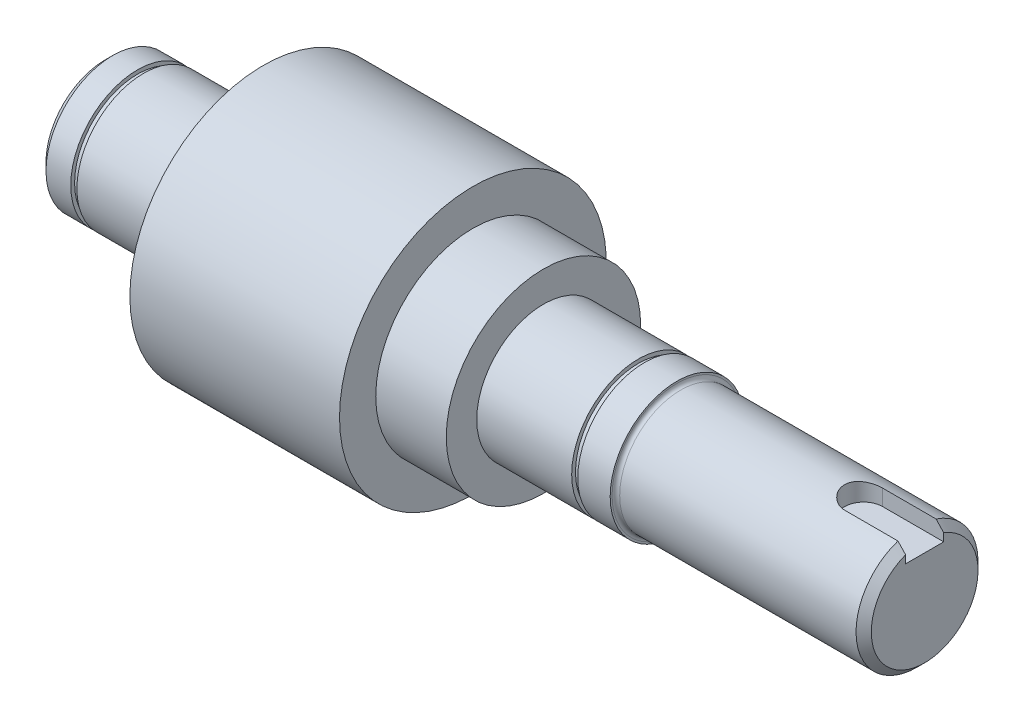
SolidWorks part; units mm, degrees
ref_plane "Plan1" through (0, 0, 0) normal (0, 0, 1) x (1, 0, 0)
ref_plane "Plan2" through (0, 0, 0) normal (0, 1, 0) x (1, 0, 0)
ref_plane "Plan3" through (0, 0, 0) normal (1, 0, 0) x (0, 0, -1)
sketch "Esquisse1" plane through (0, 0, 0) normal (0, 0, 1) x (1, 0, 0)
  line L0 (-77.9877, 0) -> (164.4815, 0) construction
  line L1 (-27.5, 35) -> (27.5, 35)
  line L2 (-27.5, 35) -> (-27.5, 25.5)
  line L3 (146, 16) -> (146, 0)
  line L4 (27.5, 35) -> (27.5, 25.5)
  line L5 (-34, 25.5) -> (-27.5, 25.5)
  line L6 (-34, 25.5) -> (-34, 17.5)
  line L7 (-69, 0) -> (146, 0)
  line L8 (-69, 17.5) -> (-69, 0)
  line L9 (46, 25.5) -> (46, 17.5)
  line L10 (27.5, 25.5) -> (46, 25.5)
  line L11 (-69, 17.5) -> (-60.5, 17.5)
  line L12 (81, 17.5) -> (81, 17)
  line L13 (-60.5, 17.5) -> (-60.5, 16.5)
  line L14 (82, 16) -> (146, 16)
  line L15 (46, 17.5) -> (70.9, 17.5)
  line L16 (-58.9, 17.5) -> (-58.9, 16.5)
  line L17 (70.9, 17.5) -> (70.9, 16.5)
  line L18 (-58.9, 17.5) -> (-34, 17.5)
  line L19 (-60.5, 16.5) -> (-58.9, 16.5)
  line L20 (72.5, 17.5) -> (72.5, 16.5)
  line L21 (70.9, 16.5) -> (72.5, 16.5)
  line L22 (72.5, 17.5) -> (81, 17.5)
  arc A0 (82, 16) -> (81, 17) centre (82, 17) cw
  dimension "D11" = 1
  dimension "D1" = 26.5
  dimension "D2" = 34
  dimension "D3" = 80
  dimension "D4" = 100
  dimension "D5" = 35
  dimension "D6" = 1.6
  dimension "D7" = 35
  dimension "D8" = 17.5
  dimension "D9" = 16
  dimension "D10" = 55
  dimension "D12" = 26.5
  dimension "D13" = 1.6
  dimension "D14" = 6.5
revolve "Base-Révolution" add sketch "Esquisse1" angle 360 about L0
chamfer "Chanfrein1" distance 2 angle 45
ref_plane "Plan6" through (0, 16, 0) normal (0, 1, 0) x (-1, 0, 0)
sketch "Esquisse4" plane through (0, 16, 0) normal (0, 1, 0) x (-1, 0, 0)
  line L0 (0, 0) -> (-169.4921, 0) construction
  line L1 (-130, -5) -> (-146, -5)
  line L3 (-130, 5) -> (-146, 5)
  line L4 (-146, -5) -> (-146, 5)
  arc A0 (-130, -5) -> (-130, 5) centre (-130, 0) ccw
  dimension "D3" = 10
  dimension "D1" = 130
  dimension "D2" = 146
extrude "Enlèv. mat.-Extru.3" cut sketch "Esquisse4" against normal blind 5
